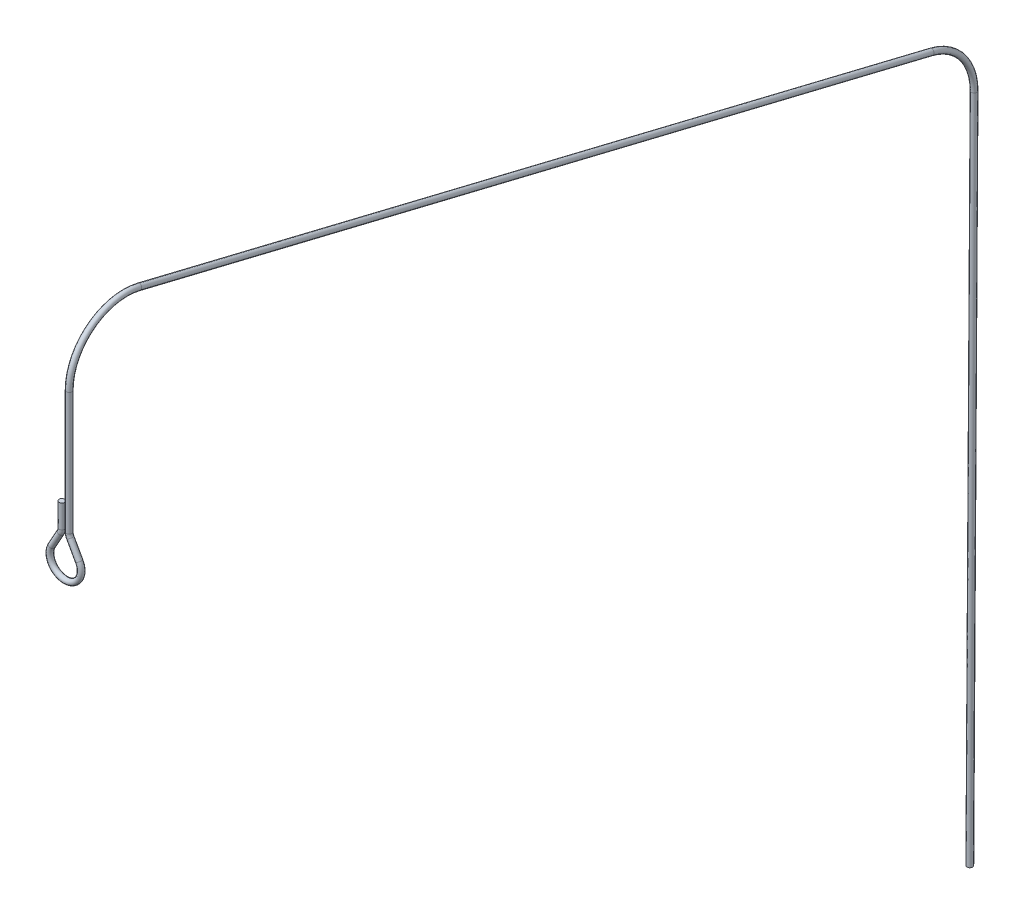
SolidWorks part; units mm, degrees
ref_plane "Plan de face" through (0, 0, 0) normal (0, 0, 1) x (1, 0, 0)
ref_plane "Plan de dessus" through (0, 0, 0) normal (0, 1, 0) x (1, 0, 0)
ref_plane "Plan de droite" through (0, 0, 0) normal (1, 0, 0) x (0, 0, -1)
sketch "Esquisse2" plane through (0, 0, 0) normal (1, 0, 0) x (0, 0, -1)
  line L0 (7.8195, 1960.3964) -> (3.9991, 1360.3964)
  line L3 (-803.9122, 2133.6116) -> (-803.9122, 2033.6116)
  line L4 (-741.4757, 2182.6806) -> (-30.7429, 2009.787)
  circle A0 centre (-42.6795, 1960.718) radius 60 construction
  circle A1 centre (-753.4122, 2133.6116) radius 60 construction
  arc A2 (7.8195, 1960.3964) -> (-30.7429, 2009.787) centre (-42.6795, 1960.718) ccw
  arc A4 (-741.4757, 2182.6806) -> (-803.9122, 2133.6116) centre (-753.4122, 2133.6116) ccw
  dimension "D1" = 50.5
  dimension "D2" = 50.5
  dimension "D3" = 100
  dimension "D4" = 600
ref_plane "Plan4" through (0, 2033.6116, 0) normal (0, 1, 0) x (-1, 0, 0)
sketch "Esquisse3" plane through (0, 2033.6116, 0) normal (0, 1, 0) x (-1, 0, 0)
  circle A0 centre (0, 803.9122) radius 2.5
  dimension "D1" = 5
sweep "Balayage3" add profiles "Esquisse3" path "Esquisse2"
ref_plane "Plan5" through (0, 0, 803.9122) normal (0, 0, 1) x (1, 0, 0)
sketch "Esquisse5" plane through (0, 0, 803.9122) normal (0, 0, 1) x (1, 0, 0)
  line L0 (-7.5126, 2019.7159) -> (-15.4779, 2005.429)
  line L1 (-3.25, 2027.4469) -> (-3.25, 1999.5876) construction
  line L2 (1.0126, 2019.7159) -> (8.9779, 2005.429)
  line L3 (0, 2023.6116) -> (0, 2033.6116)
  line L5 (-6.5, 2023.6116) -> (-6.5, 2044.4377)
  line L6 (18.15, 2033.6116) -> (-18.15, 2033.6116) construction
  arc A1 (-7.5126, 2019.7159) -> (-6.5, 2023.6116) centre (-14.5, 2023.6116) ccw
  arc A2 (1.0126, 2019.7159) -> (0, 2023.6116) centre (8, 2023.6116) cw
  arc A3 (-15.4779, 2005.429) -> (8.9779, 2005.429) centre (-3.25, 1998.6116) ccw
  dimension "D1" = 3.25
  dimension "D2" = 8
  dimension "D6" = 14
  dimension "D4" = 10
  dimension "D5" = 35
sketch "Esquisse6" plane through (0, 2033.6116, 0) normal (0, 1, 0) x (-1, 0, 0)
  circle A0 centre (0, 803.9122) radius 2.5
sweep "Balayage4" add profiles "Esquisse6" path "Esquisse5"
